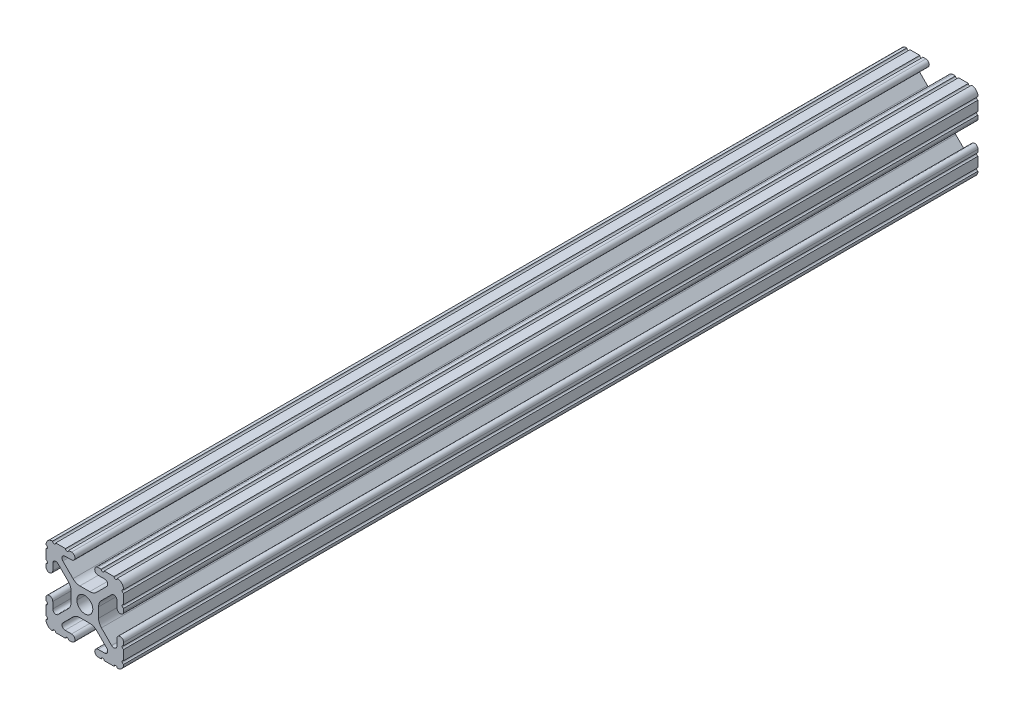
SolidWorks part; units mm, degrees
ref_plane "Front Plane" through (0, 0, 0) normal (0, 0, 1) x (1, 0, 0)
ref_plane "Top Plane" through (0, 0, 0) normal (0, 1, 0) x (1, 0, 0)
ref_plane "Right Plane" through (0, 0, 0) normal (1, 0, 0) x (0, 0, -1)
imported_body "1010_12_CL.sldprt"
sketch "Sketch1" plane through (0, 0, 0) normal (0, 0, 1) x (1, 0, 0)
  line L1 (-40.2791, 38.2821) -> (38.1267, 38.2821)
  line L2 (-40.2791, 38.2821) -> (-40.2791, -52.7101)
  line L3 (-40.2791, -52.7101) -> (38.1267, -52.7101)
  line L4 (38.1267, 38.2821) -> (38.1267, -52.7101)
extrude "Cut-Extrude1" cut sketch "Sketch1" against normal blind 25.4
